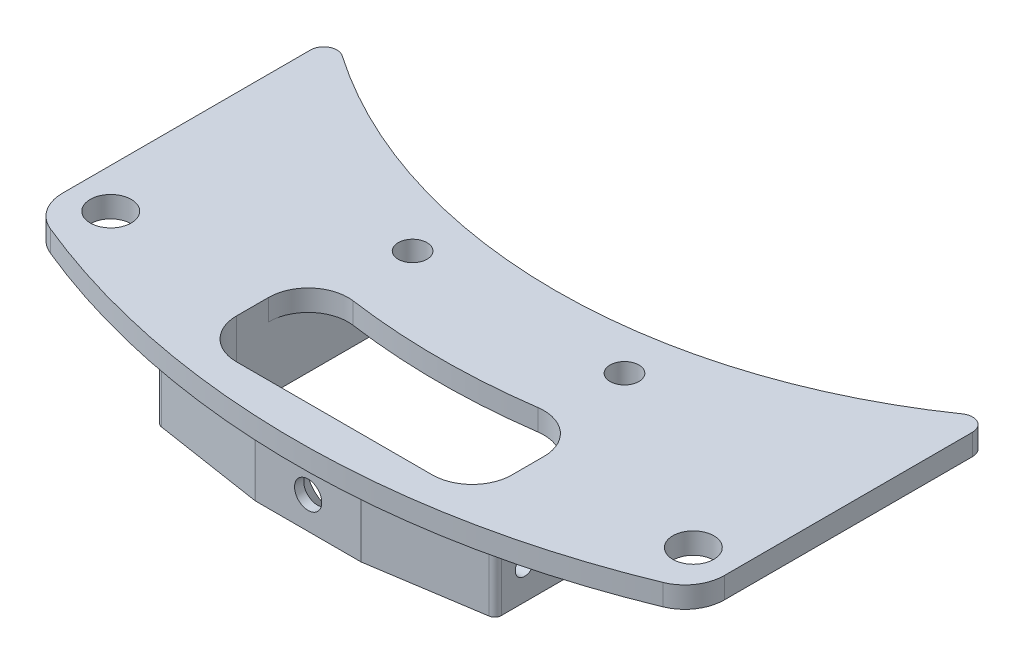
SolidWorks part; units mm, degrees
ref_plane "Front Plane" through (0, 0, 0) normal (0, 0, 1) x (1, 0, 0)
ref_plane "Top Plane" through (0, 0, 0) normal (0, 1, 0) x (1, 0, 0)
ref_plane "Right Plane" through (0, 0, 0) normal (1, 0, 0) x (0, 0, -1)
sketch "Sketch1" plane through (0, 0, 0) normal (0, 1, 0) x (1, 0, 0)
  line L0 (0, 0) -> (0, -96.52) construction
  line L1 (-39.6875, -84.8509) -> (-39.6875, -51.9877)
  line L3 (-16.51, -83.3134) -> (-16.51, -87.1594)
  line L4 (-11.7475, -91.9219) -> (11.7475, -91.9219)
  line L5 (16.51, -87.1594) -> (16.51, -83.3134)
  line L7 (39.6875, -51.9877) -> (39.6875, -84.8509)
  arc A0 (-36.7377, -89.255) -> (36.7377, -89.255) centre (0, 0) ccw
  arc A1 (36.7377, -89.255) -> (39.6875, -84.8509) centre (34.925, -84.8509) ccw
  arc A2 (-36.7377, -89.255) -> (-39.6875, -84.8509) centre (-34.925, -84.8509) cw
  arc A3 (11.0825, -78.5975) -> (-11.0825, -78.5975) centre (0, 0) cw
  circle A4 centre (-34.925, -83.82) radius 4.7625 construction
  arc A5 (11.7475, -91.9219) -> (16.51, -87.1594) centre (11.7475, -87.1594) ccw
  arc A6 (-16.51, -87.1594) -> (-11.7475, -91.9219) centre (-11.7475, -87.1594) ccw
  arc A7 (-42.9983, -49.2845) -> (-4.445, -65.2538) centre (0, 0) ccw construction
  arc A9 (-39.6875, -51.9877) -> (39.6875, -51.9877) centre (0, 0) ccw
  arc A10 (-11.0825, -78.5975) -> (-16.51, -83.3134) centre (-11.7475, -83.3134) ccw
  arc A11 (11.0825, -78.5975) -> (16.51, -83.3134) centre (11.7475, -83.3134) cw
  point P14 (39.6875, -87.983)
  point P17 (-39.6875, -87.983)
  dimension "D1" = 96.52
  dimension "D2" = 4.7625
  dimension "D3" = 4.7625
  dimension "D4" = 3.81
  dimension "D6" = 79.375
  dimension "D5" = 33.02
extrude "Boss-Extrude1" add sketch "Sketch1" along normal blind 2.54
sketch "Sketch2" plane through (0, 0, 0) normal (0, -1, 0) x (1, 0, 0)
  line L0 (-11.7475, 91.9219) -> (11.7475, 91.9219)
  line L1 (-19.6475, 93.0203) -> (-6.4103, 95.0661)
  line L3 (-6.289, 95.0754) -> (6.289, 95.0754)
  line L5 (6.4103, 95.0661) -> (19.6475, 93.0203)
  line L7 (-20.32, 62.1684) -> (-20.32, 92.2359)
  line L8 (20.32, 62.1684) -> (20.32, 92.2359)
  line L11 (16.51, 63.2869) -> (16.51, 87.1594)
  line L12 (16.51, 83.3134) -> (16.51, 87.1594) construction
  line L13 (-16.51, 63.2869) -> (-16.51, 87.1594)
  line L17 (0, 96.52) -> (0, 52.5719) construction
  arc A0 (39.6875, 51.9877) -> (-39.6875, 51.9877) centre (0, 0) ccw construction
  arc A1 (-11.7475, 91.9219) -> (-16.51, 87.1594) centre (-11.7475, 87.1594) ccw construction
  arc A3 (20.32, 92.2359) -> (19.6475, 93.0203) centre (19.5263, 92.2359) ccw
  arc A4 (20.32, 92.2359) -> (19.6475, 93.0203) centre (19.5263, 92.2359) ccw
  arc A5 (39.6875, 51.9877) -> (-39.6875, 51.9877) centre (0, 0) ccw construction
  arc A6 (6.4103, 95.0661) -> (6.289, 95.0754) centre (6.289, 94.2816) ccw
  arc A7 (20.32, 62.1684) -> (16.51, 63.2869) centre (0, 0) ccw
  arc A8 (-16.51, 63.2869) -> (-20.32, 62.1684) centre (0, 0) ccw
  arc A9 (11.7475, 91.9219) -> (16.51, 87.1594) centre (11.7475, 87.1594) cw
  arc A10 (6.4103, 95.0661) -> (6.289, 95.0754) centre (6.289, 94.2816) ccw
  arc A11 (-6.289, 95.0754) -> (-6.4103, 95.0661) centre (-6.289, 94.2816) ccw
  arc A12 (-6.289, 95.0754) -> (-6.4103, 95.0661) centre (-6.289, 94.2816) ccw
  arc A13 (-19.6475, 93.0203) -> (-20.32, 92.2359) centre (-19.5262, 92.2359) ccw
  arc A14 (-19.6475, 93.0203) -> (-20.32, 92.2359) centre (-19.5262, 92.2359) ccw
  arc A20 (16.51, 87.1594) -> (11.7475, 91.9219) centre (11.7475, 87.1594) ccw construction
  arc A21 (-11.7475, 91.9219) -> (-16.51, 87.1594) centre (-11.7475, 87.1594) ccw
  dimension "D1" = 0
  dimension "D3" = 0
  dimension "D4" = 0
  dimension "D5" = 0
extrude "Boss-Extrude2" add sketch "Sketch2" along normal blind 7.62
fillet "Fillet1" radius 1.5875 6 edges at (16.51, -3.81, 63.2869) (39.6875, 1.27, 51.9877) (20.32, -3.81, 62.1684) (-20.32, -3.81, 62.1684) (-16.51, -3.81, 63.2869) (-39.6875, 1.27, 51.9877)
hole_wizard "#10 (0.1935) Diameter Hole1" positions "Sketch3" profile "Sketch4" hole size "#10" standard "ANSI Inch"
sketch "Sketch3" plane through (0, 0, 0) normal (0, -1, 0) x (-1, 0, 0)
  circle A3 centre (34.925, -83.82) radius 4.7625 construction
  circle A5 centre (-34.925, -83.82) radius 4.7625 construction
  point P0 (-34.925, -83.82)
  point P2 (34.925, -83.82)
  point P25 (0, 0)
  point P26 (0, 0)
  point P27 (0, 0)
  point P28 (-47.1538, -84.6647)
  point P29 (0, 0)
sketch "Sketch4" plane through (34.925, 0, 83.82) normal (1, 0, 0) x (0, 0, -1)
  line L0 (0, 0) -> (0, 2.54)
  line L1 (0, 2.54) -> (2.4574, 2.54)
  line L2 (2.4574, 2.54) -> (2.4574, 0)
  line L5 (2.4574, 0) -> (0, 0)
  line L11 (0, -6.35) -> (0, 107.95) construction
  dimension "Thru Hole Dia." = 4.9149
  dimension "Thru Hole Depth" = 2.54
hole_wizard "#8-32 Tapped Hole1" positions "Sketch5" profile "Sketch6" tap size "#8-32" standard "ANSI Inch"
sketch "Sketch5" plane through (0, 0, 0) normal (0, -1, 0) x (-1, 0, 0)
  line L0 (0, 0) -> (0, -78.682) construction
  arc A0 (-17.6686, -62.9733) -> (17.6686, -62.9733) centre (0, 0) ccw construction
  point P0 (-12.7, -69.85)
  point P2 (12.7, -69.85)
  dimension "D2" = 4.445
  dimension "D1" = 25.4
sketch "Sketch6" plane through (12.7, 0, 69.85) normal (1, 0, 0) x (0, 0, -1)
  line L0 (0, 0) -> (0, 2.54)
  line L1 (0, 2.54) -> (1.7272, 2.54)
  line L2 (1.7272, 2.54) -> (1.7272, 0)
  line L5 (1.7272, 0) -> (0, 0)
  line L11 (0, -6.35) -> (0, 107.95) construction
  dimension "Thru Tap Drill Dia." = 3.4544
  dimension "Thru Tap Drill Depth" = 2.54
hole_wizard "#4-40 Tapped Hole1" positions "Sketch7" profile "Sketch8" tap size "#4-40" standard "ANSI Inch"
sketch "Sketch7" plane through (-20.32, 0, 0) normal (-1, 0, 0) x (0, 0, 1)
  circle A0 centre (89.4346, -3.81) radius 1.5875 construction
  point P0 (89.4346, -3.81)
sketch "Sketch8" plane through (-20.32, -3.81, 89.4346) normal (0, 1, 0) x (0, 0, 1)
  line L0 (0, 0) -> (0, 60.0075)
  line L1 (0, 60.0075) -> (1.1303, 60.0075)
  line L2 (1.1303, 60.0075) -> (1.1303, 0)
  line L5 (1.1303, 0) -> (0, 0)
  line L11 (0, -6.35) -> (0, 107.95) construction
  dimension "Thread Major Dia." = 2.2606
  dimension "Thru Tap Drill Depth" = 60.0075
hole_wizard "CSK for #4 Flat Head Machine Screw1" positions "Sketch9" profile "Sketch10" countersink size "#4" standard "ANSI Inch"
sketch "Sketch9" plane through (0, 0, 91.9219) normal (0, 0, -1) x (-1, 0, 0)
  line L0 (0, -7.62) -> (0, 0) construction
  line L1 (11.7475, -7.62) -> (-11.7475, -7.62) construction
  line L3 (-6.289, 0) -> (6.289, 0) construction
  point P0 (0, -3.81)
sketch "Sketch10" plane through (0, -3.81, 91.9219) normal (1, 0, 0) x (0, 1, 0)
  line L0 (0, 0) -> (0, 4.5981)
  line L1 (0, 4.5981) -> (1.6319, 4.5981)
  line L2 (1.6319, 4.5981) -> (1.6319, 2.0448)
  line L3 (1.6319, 2.0448) -> (3.4095, 0)
  line L5 (3.4095, 0) -> (0, 0)
  line L6 (-1.6319, 2.0448) -> (-3.4095, 0) construction
  line L11 (0, -6.35) -> (0, 107.95) construction
  dimension "Thru Hole Dia." = 3.2639
  dimension "Thru Hole Depth" = 4.5981
  dimension "Near C'Sink Dia." = 6.819
  dimension "Near C'Sink Angle" = 82
